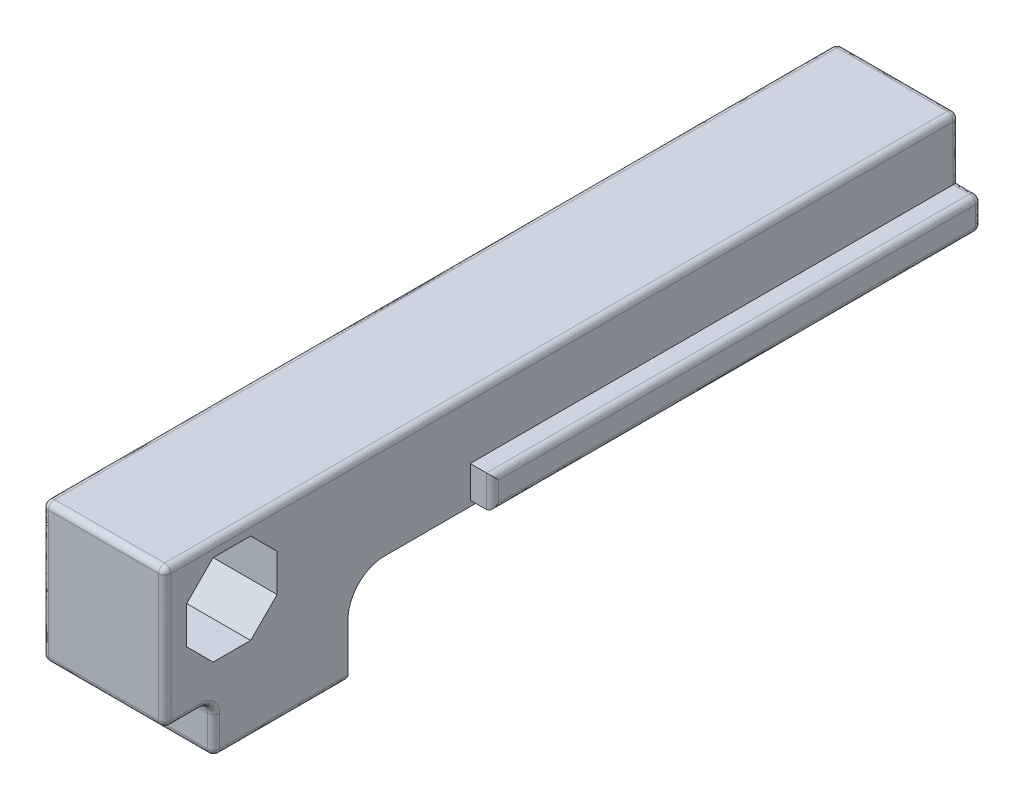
SolidWorks part; units mm, degrees
ref_plane "Front Plane" through (0, 0, 0) normal (0, 0, 1) x (1, 0, 0)
ref_plane "Top Plane" through (0, 0, 0) normal (0, 1, 0) x (1, 0, 0)
ref_plane "Right Plane" through (0, 0, 0) normal (1, 0, 0) x (0, 0, -1)
sketch "Sketch1" plane through (0, 0, 0) normal (1, 0, 0) x (0, 0, -1)
  line L0 (0, 0) -> (0, -11.4)
  line L1 (4, -15.4) -> (15, -15.4)
  line L2 (15, -15.4) -> (15, -8)
  line L3 (15, -8) -> (65, -8)
  line L4 (65, -8) -> (65, 0)
  line L5 (65, 0) -> (16.0063, 0)
  line L7 (16.0063, 0) -> (0, 0)
  line L9 (4, -11.4) -> (4, -15.4)
  line L10 (4, -11.4) -> (0, -11.4)
  dimension "D1" = 65
  dimension "D2" = 7.4
  dimension "D3" = 8
  dimension "D4" = 11
  dimension "D5" = 4
  dimension "D6" = 4
extrude "Boss-Extrude1" add sketch "Sketch1" along normal mid plane 10
fillet "Fillet1" radius 3 1 edges at (0, -8, -15)
sketch "Sketch2" plane through (0, 0, -65) normal (0, 0, -1) x (-1, 0, 0)
  line L0 (5, -8) -> (5, 0) construction
  line L1 (5, -4.95) -> (6.83, -4.95)
  line L2 (5, -4.95) -> (5, -7.55)
  line L3 (5, -7.55) -> (6.83, -7.55)
  line L4 (6.83, -4.95) -> (6.83, -7.55)
  line L5 (-5, -8) -> (-5, 0) construction
  line L6 (-5, -4.95) -> (-6.83, -4.95)
  line L7 (-5, -4.95) -> (-5, -7.55)
  line L8 (-5, -7.55) -> (-6.83, -7.55)
  line L9 (-6.83, -4.95) -> (-6.83, -7.55)
  line L10 (-5, -8) -> (5, -8) construction
  dimension "D1" = 0.45
  dimension "D2" = 2.6
  dimension "D3" = 1.83
extrude "Boss-Extrude2" add sketch "Sketch2" against normal blind 40 contours L4 L1 L3 M6 | L6 L9 L8 L7
fillet "Fillet2" radius 1 1 edges at (0, -11.4, -4)
fillet "Fillet3" radius 0.5 34 edges at (0, 0, 0) (0, -11.4, 0) (5, -2.475, -65) (5, -7.775, -65) (5, -13.9, -4) (5, -11.6929, -3.7071) (5, -11.4, -1.5) (5, 0, -32.5) (-5, -11.4, -1.5) (-5, -11.6929, -3.7071) (-5, -13.9, -4) (-5, -7.775, -65) (-5, -2.475, -65) (-5, 0, -32.5) (0, -15.4, -4) (5, -15.4, -9.5) (0, -15.4, -15) (-5, -15.4, -9.5) (0, -8, -65) (0, 0, -65) (5.915, -4.95, -65) (-5.915, -4.95, -65) (5, -5.7, 0) (-5, -5.7, 0) (6.83, -4.95, -45) (6.83, -6.25, -65) (6.83, -6.25, -25) (6.83, -7.55, -45) (-6.83, -6.25, -65) (-6.83, -6.25, -25) (-6.83, -4.95, -45) (-6.83, -7.55, -45) (5.915, -7.55, -65) (-5.915, -7.55, -65)
sketch "Sketch3" plane through (-5, 0, 0) normal (-1, 0, 0) x (0, 0, 1)
  line L0 (-25, -7.55) -> (-64.5, -7.55) construction
  line L1 (-25, -7.55) -> (-64.5, -7.55)
  line L2 (0, -0.5) -> (0, -10.9) construction
  line L3 (-64.5, 0) -> (-0.5, 0) construction
  line L11 (-1.8, -3.2674) -> (-3.9674, -1.1)
  line L12 (-3.9674, -1.1) -> (-7.0326, -1.1)
  line L13 (-7.0326, -1.1) -> (-9.2, -3.2674)
  line L14 (-9.2, -3.2674) -> (-9.2, -6.3326)
  line L15 (-9.2, -6.3326) -> (-7.0326, -8.5)
  line L16 (-7.0326, -8.5) -> (-3.9674, -8.5)
  line L17 (-3.9674, -8.5) -> (-1.8, -6.3326)
  line L18 (-1.8, -6.3326) -> (-1.8, -3.2674)
  circle A0 centre (-5.5, -4.8) radius 3.7
  circle A1 centre (-5.5, -4.8) radius 3.7 construction
  dimension "D1" = 7.4
  dimension "D2" = 5.5
  dimension "D3" = 4.8
extrude "Cut-Extrude1" cut sketch "Sketch3" against normal through all contours L12 L13 L14 L15 L16 L17 L18 L11
sketch "Sketch4" plane through (0, 0, -65) normal (0, 0, -1) x (-1, 0, 0)
  line L0 (5, -8) -> (-5, -8) construction
  line L1 (5, -8) -> (-5, -8)
  line L2 (-5, -8) -> (5, -8) construction
  arc A0 (3.75, -8) -> (-3.75, -8) centre (0, -9.3919) ccw
  point P5 (0, -8)
  dimension "D1" = 4
  dimension "D2" = 7.5
extrude "Cut-Extrude2" cut sketch "Sketch4" against normal blind 15 and the other way through all
fillet "Fillet4" radius 0.5 5 edges at (-3.6853, -7.8368, -64.8695) (3.7125, -7.9028, -64.7963)
scale "Scale1" scale about centroid uniform scaling yes scale factor 0.95
